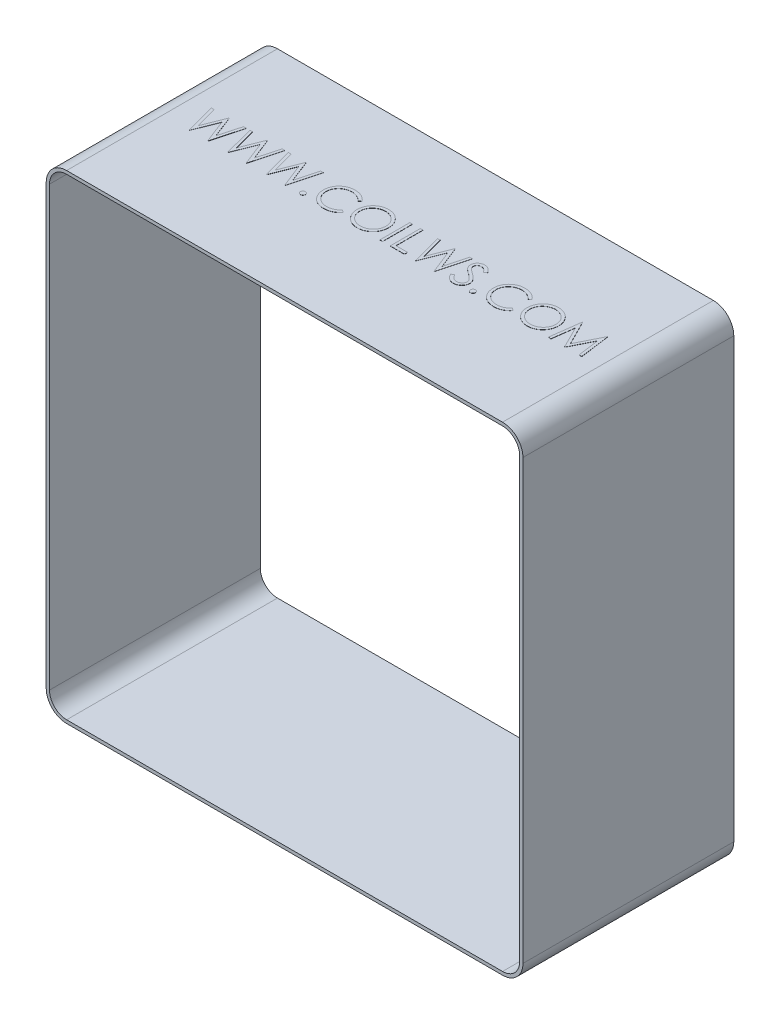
SolidWorks part; units mm, degrees
ref_plane "Front Plane" through (0, 0, 0) normal (0, 0, 1) x (1, 0, 0)
ref_plane "Top Plane" through (0, 0, 0) normal (0, 1, 0) x (1, 0, 0)
ref_plane "Right Plane" through (0, 0, 0) normal (1, 0, 0) x (0, 0, -1)
sketch "Sketch1" plane through (0, 0, 0) normal (0, 0, 1) x (1, 0, 0)
  line L2 (-27.43, 18.05) -> (-27.43, -7.51) construction
  line L3 (-25.43, -9.51) -> (25.43, -9.51) construction
  line L4 (27.43, 18.05) -> (27.43, -7.51) construction
  line L6 (27.43, 18.05) -> (27.43, 43.61) construction
  line L7 (25.43, 45.61) -> (-25.43, 45.61) construction
  line L8 (-27.43, 18.05) -> (-27.43, -7.51)
  line L9 (-25.43, -9.51) -> (25.43, -9.51)
  line L10 (27.43, 18.05) -> (27.43, -7.51)
  line L11 (-27.43, 18.05) -> (-27.43, 43.61) construction
  line L12 (27.43, 18.05) -> (27.43, 43.61)
  line L13 (25.43, 45.61) -> (-25.43, 45.61)
  line L14 (-27.43, 18.05) -> (-27.43, 43.61)
  arc A1 (-27.43, -7.51) -> (-25.43, -9.51) centre (-25.43, -7.51) ccw construction
  arc A2 (25.43, -9.51) -> (27.43, -7.51) centre (25.43, -7.51) ccw construction
  arc A4 (27.43, 43.61) -> (25.43, 45.61) centre (25.43, 43.61) ccw construction
  arc A5 (-27.43, -7.51) -> (-25.43, -9.51) centre (-25.43, -7.51) ccw
  arc A6 (25.43, -9.51) -> (27.43, -7.51) centre (25.43, -7.51) ccw
  arc A7 (-25.43, 45.61) -> (-27.43, 43.61) centre (-25.43, 43.61) ccw construction
  arc A8 (27.43, 43.61) -> (25.43, 45.61) centre (25.43, 43.61) ccw
  arc A9 (-25.43, 45.61) -> (-27.43, 43.61) centre (-25.43, 43.61) ccw
extrude "Extrude-Thin1" add sketch "Sketch1" along normal mid plane 24.6 thin
sketch "Sketch2" plane through (0, 0, 0) normal (0, 1, 0) x (1, 0, 0)
  text T0 "WWW.COILWS.COM"
wrap "Wrap1" sketch "Sketch2" wrap type emboss source sketch "Sketch2" thickness 0.02 parameters "D1"=0.02
